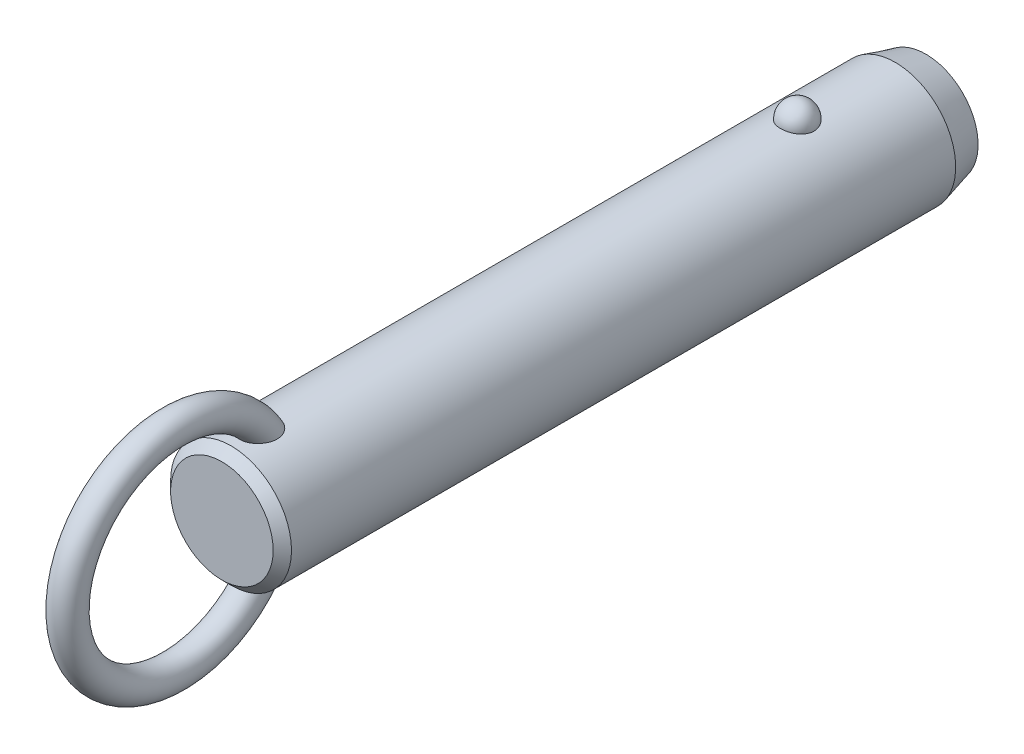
SolidWorks part; units mm, degrees
ref_plane "Front Plane" through (0, 0, 0) normal (0, 0, 1) x (1, 0, 0)
ref_plane "Top Plane" through (0, 0, 0) normal (0, 1, 0) x (1, 0, 0)
ref_plane "Right Plane" through (0, 0, 0) normal (1, 0, 0) x (0, 0, -1)
sketch "Sketch2" plane through (0, 0, 0) normal (0, 0, 1) x (1, 0, 0)
  circle A0 centre (0, 0) radius 7.9
  point P3 (0, 7.9)
  dimension "D1" = 15.8
extrude "Boss-Extrude1" add sketch "Sketch2" along normal blind 63.5
sketch "Sketch3" plane through (0, 0, 0) normal (0, 0, -1) x (-1, 0, 0)
  circle A0 centre (0, 0) radius 7.9
  dimension "D1" = 15.8
extrude "Boss-Extrude2" add sketch "Sketch3" along normal blind 19
chamfer "Chamfer1" distance 4 angle 15 1 edges at (-7.9, 0, -19)
sketch "Sketch12" plane through (0, 0, 0) normal (1, 0, 0) x (0, 0, -1)
  line L0 (-63.5, 7.9) -> (-63.5, -7.9) construction
  point P0 (-63.5, 0)
sketch "Sketch13" plane through (0, 0, 0) normal (1, 0, 0) x (0, 0, -1)
  circle A0 centre (-79.35, 0) radius 15.85
  point P2 (-63.5, 0)
  dimension "D1" = 31.7
sketch "Sketch14" plane through (0, 0, 0) normal (0, 1, 0) x (1, 0, 0)
  circle A0 centre (0, -65.5) radius 2
  point P2 (0, -63.5)
  dimension "D1" = 4
sweep "Sweep1" add profiles "Sketch14" path "Sketch13"
sketch "Sketch15" plane through (0, 0, 63.5) normal (0, 0, 1) x (1, 0, 0)
  circle A0 centre (0, 0) radius 7.9
  dimension "D1" = 15.8
extrude "Boss-Extrude3" add sketch "Sketch15" along normal blind 9.52
chamfer "Chamfer2" distance 1.2 angle 45 1 edges at (7.9, 0, 73.02)
sketch "Sketch18" plane through (0, 0, 0) normal (1, 0, 0) x (0, 0, -1)
  line L0 (15, 7.9) -> (-65.6091, 7.9) construction
  line L1 (2.2, 10.1) -> (2.2, 5.7)
  line L2 (-65.6091, -7.9) -> (15, -7.9) construction
  arc A0 (2.2, 10.1) -> (2.2, 5.7) centre (2.2, 7.9) ccw
  point P4 (0, 7.9)
  dimension "D1" = 18
revolve "Revolve1" add sketch "Sketch18" angle 360 about L1
